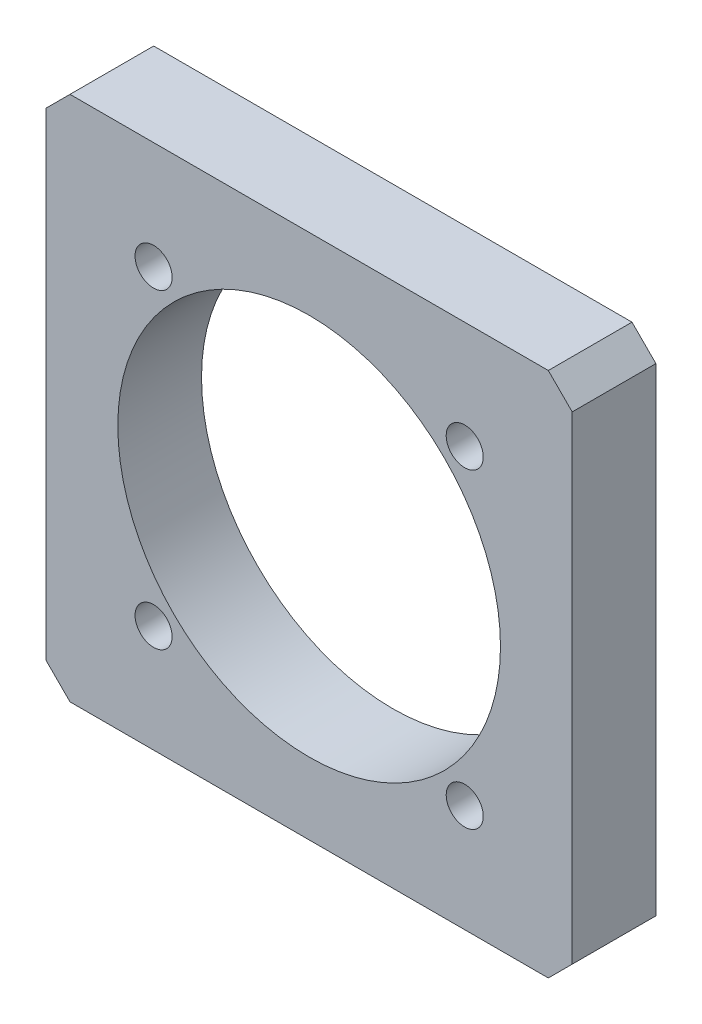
SolidWorks part; units mm, degrees
ref_plane "Plan de face" through (0, 0, 0) normal (0, 0, 1) x (1, 0, 0)
ref_plane "Plan de dessus" through (0, 0, 0) normal (0, 1, 0) x (1, 0, 0)
ref_plane "Plan de droite" through (0, 0, 0) normal (1, 0, 0) x (0, 0, -1)
sketch "Esquisse1" plane through (0, 0, 0) normal (0, 0, 1) x (1, 0, 0)
  line L1 (-110, 110) -> (110, 110)
  line L2 (-110, 110) -> (-110, -110)
  line L3 (-110, -110) -> (110, -110)
  line L4 (110, 110) -> (110, -110)
  circle A0 centre (0, 0) radius 110 construction
  circle A5 centre (0, 0) radius 80
  dimension "D1" = 160
extrude "Boss.-Extru.1" add sketch "Esquisse1" along normal blind 35
hole_wizard "Trou taraudé M181" positions "Esquisse3" profile "Esquisse2" tap size "M18" standard "ISO"
sketch "Esquisse3" plane through (0, 0, 0) normal (0, 0, -1) x (-1, 0, 0)
  point P0 (65.0538, 65.0538)
  point P2 (-65.0538, 65.0538)
  point P4 (-65.0538, -65.0538)
  point P6 (65.0538, -65.0538)
sketch "Esquisse2" plane through (-65.0538, 65.0538, 0) normal (1, 0, 0) x (0, 1, 0)
  line L0 (0, 0) -> (0, 35)
  line L1 (0, 35) -> (7.75, 35)
  line L2 (7.75, 35) -> (7.75, 0)
  line L5 (7.75, 0) -> (0, 0)
  line L11 (0, -6.35) -> (0, 107.95) construction
  dimension "Diamètre du trou pour taraudage jusqu'au prochain" = 15.5
  dimension "Profondeur du trou pour taraudage jusqu'au prochain" = 35
chamfer "Chanfrein1" distance 10 angle 45 4 edges at (-110, -110, 17.5) (-110, 110, 17.5) (110, -110, 17.5) (110, 110, 17.5)
